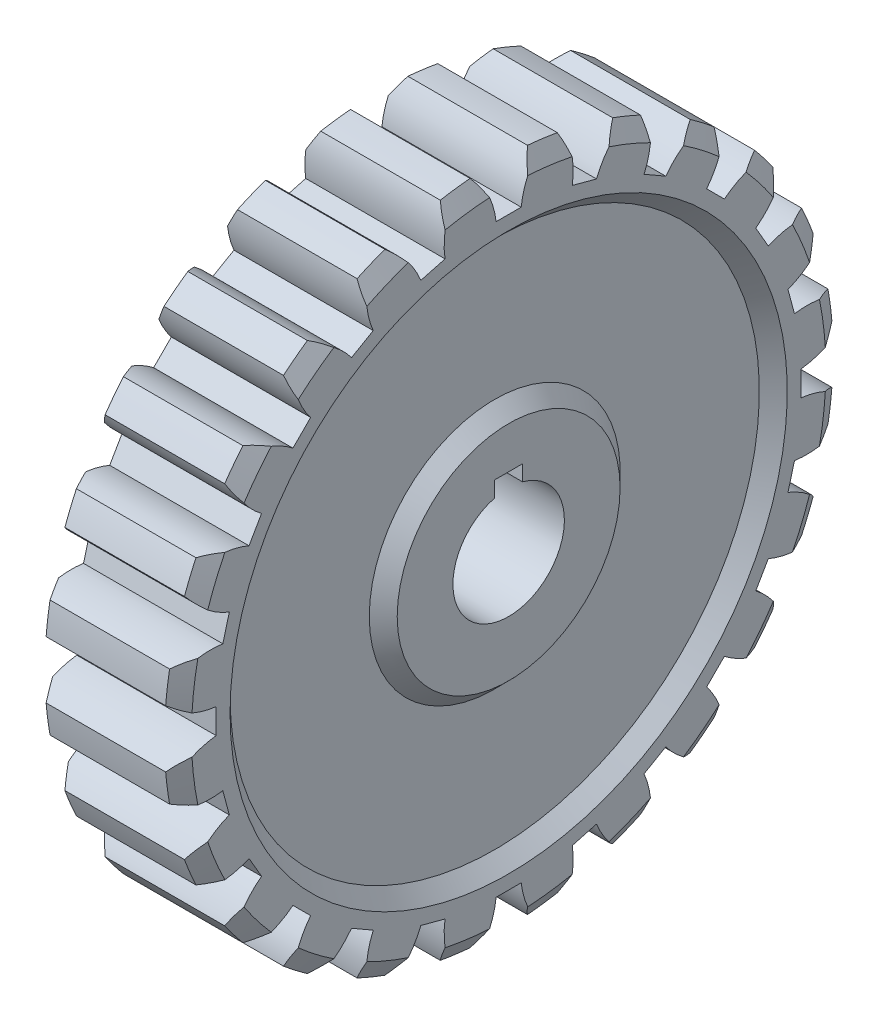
SolidWorks part; units mm, degrees
ref_plane "Front Plane" through (0, 0, 0) normal (0, 0, 1) x (1, 0, 0)
ref_plane "Top Plane" through (0, 0, 0) normal (0, 1, 0) x (1, 0, 0)
ref_plane "Right Plane" through (0, 0, 0) normal (1, 0, 0) x (0, 0, -1)
sketch "Sketch1" plane through (0, 0, 0) normal (0, 0, 1) x (1, 0, 0)
  line L0 (0, 0) -> (0, 76.5048) construction
  line L1 (-15.875, 12.7) -> (15.875, 12.7)
  line L2 (15.875, 12.7) -> (15.875, 25.4)
  line L3 (-15.875, 12.7) -> (-15.875, 25.4)
  line L4 (15.875, 25.4) -> (12.7, 28.5946)
  line L5 (-15.875, 25.4) -> (-12.7, 28.5946)
  line L6 (12.7, 28.5946) -> (12.7, 60.3054)
  line L7 (-12.7, 28.5946) -> (-12.7, 60.3054)
  line L8 (12.7, 60.3054) -> (15.875, 63.5)
  line L9 (-12.7, 60.3054) -> (-15.875, 63.5)
  line L10 (15.875, 63.5) -> (15.875, 72.2994)
  line L11 (-15.875, 63.5) -> (-15.875, 72.2994)
  line L12 (15.875, 72.2994) -> (13.623, 76.2)
  line L13 (0, 0) -> (51.1714, 0) construction
  line L14 (-15.875, 72.2994) -> (-13.623, 76.2)
  line L15 (13.623, 76.2) -> (-13.623, 76.2)
  point P15 (0, 12.7)
  point P18 (0, 76.2)
  point P20 (0, 12.7)
  point P22 (0, 12.7)
  dimension "D1" = 76.5048
  dimension "D2" = 25.4
  dimension "D3" = 31.75
  dimension "D4" = 25.4
  dimension "D5" = 63.5
  dimension "D6" = 76.2
  dimension "D7" = 30
  dimension "D8" = 135.177
  dimension "D9" = 12.7
revolve "Revolve1" add sketch "Sketch1" angle 360 about L13
sketch "Sketch2" plane through (15.875, 0, 0) normal (1, 0, 0) x (0, 0, -1)
  line L0 (0, 0) -> (0, 86.6996) construction
  line L1 (-2.8575, 66.675) -> (2.8575, 66.675)
  arc A0 (2.8575, 66.675) -> (6.5405, 75.9188) centre (21.7818, 64.4906) cw
  circle A1 centre (0, 0) radius 76.2 construction
  arc A2 (-2.8575, 66.675) -> (-6.5405, 75.9188) centre (-21.7818, 64.4906) ccw
  arc A3 (6.5405, 75.9188) -> (-6.5405, 75.9188) centre (0, 0) ccw
  point P6 (0, 66.675)
  dimension "D2" = 19.05
  dimension "D1" = 5.715
  dimension "D3" = 13.081
  dimension "D4" = 66.675
extrude "Cut-Extrude1" cut sketch "Sketch2" against normal through all
sketch "Sketch3" plane through (15.875, 0, 0) normal (1, 0, 0) x (0, 0, -1)
  line L0 (0, 0) -> (0, 82.8224) construction
  line L1 (-3.175, 15.875) -> (3.175, 15.875)
  line L2 (3.175, 15.875) -> (3.175, 12.2967)
  line L3 (-3.175, 15.875) -> (-3.175, 12.2967)
  circle A0 centre (0, 0) radius 12.7 construction
  arc A1 (3.175, 12.2967) -> (-3.175, 12.2967) centre (0, 0) ccw
  point P6 (0, 15.875)
  dimension "D1" = 6.35
  dimension "D2" = 15.875
extrude "Cut-Extrude2" cut sketch "Sketch3" against normal through all
pattern_circular "CirPattern1" count 24 over 360 about axis through (0, 0, 0) along (1, 0, 0) of "Cut-Extrude1"
sketch "Sketch4" [suppressed] plane through (15.875, 0, 0) normal (1, 0, 0) x (0, 0, -1)
  line L0 (0, 0) -> (0, 76.2) construction
  line L1 (1.905, 66.675) -> (-1.905, 66.675)
  circle A0 centre (0, 0) radius 76.2 construction
  arc A1 (6.5405, 75.9188) -> (-6.5405, 75.9188) centre (0, 0) ccw
  arc A2 (-6.5405, 75.9188) -> (-1.905, 66.675) centre (-20.6123, 63.078) cw
  arc A3 (6.5405, 75.9188) -> (1.905, 66.675) centre (20.6123, 63.078) ccw
  point P8 (0, 66.675)
  dimension "D2" = 13.081
  dimension "D3" = 19.05
  dimension "D4" = 66.675
  dimension "D1" = 3.81
extrude "Cut-Extrude3" [suppressed] cut sketch "Sketch4" against normal through all
pattern_circular "CirPattern2" [suppressed] count 30 over 360
sketch "Sketch5" [suppressed] plane through (12.7, 0, 0) normal (1, 0, 0) x (0, 0, -1)
  circle A0 centre (0, 41.275) radius 4.7625
  circle A1 centre (0, 0) radius 41.275 construction
  circle A2 centre (41.275, 0) radius 4.7625
  circle A3 centre (0, -41.275) radius 4.7625
  circle A4 centre (-41.275, 0) radius 4.7625
  point P14 (0, 0)
  dimension "D1" = 82.55
  dimension "D2" = 9.525
  dimension "D3" = 4
extrude "Cut-Extrude4" [suppressed] cut sketch "Sketch5" against normal up to surface (25.4 mm away)
sketch "Sketch6" [suppressed] plane through (12.7, 0, 0) normal (1, 0, 0) x (0, 0, -1)
  circle A0 centre (0, 0) radius 41.275 construction
  circle A1 centre (0, 41.275) radius 4.7625
  circle A2 centre (35.7452, 20.6375) radius 4.7625
  circle A3 centre (35.7452, -20.6375) radius 4.7625
  circle A4 centre (0, -41.275) radius 4.7625
  circle A5 centre (-35.7452, -20.6375) radius 4.7625
  circle A6 centre (-35.7452, 20.6375) radius 4.7625
  point P17 (0, 0)
  dimension "D1" = 82.55
  dimension "D2" = 9.525
  dimension "D3" = 6
extrude "Cut-Extrude5" [suppressed] cut sketch "Sketch6" against normal up to surface (25.4 mm away)
sketch "Sketch7" [suppressed] plane through (12.7, 0, 0) normal (1, 0, 0) x (0, 0, -1)
  circle A0 centre (0, 0) radius 41.275 construction
  circle A1 centre (0, 41.275) radius 4.7625
  circle A2 centre (35.7452, -20.6375) radius 4.7625
  circle A3 centre (-35.7452, -20.6375) radius 4.7625
  point P12 (0, 0)
  dimension "D1" = 82.55
  dimension "D2" = 9.525
  dimension "D3" = 3
extrude "Cut-Extrude6" [suppressed] cut sketch "Sketch7" against normal up to surface (25.4 mm away)
